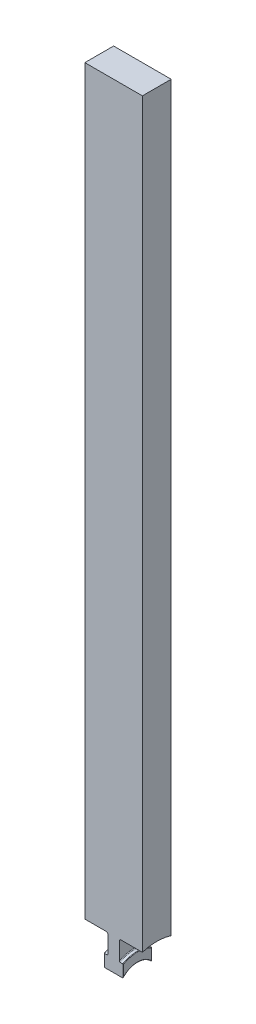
SolidWorks part; units mm, degrees
ref_plane "Front Plane" through (0, 0, 0) normal (0, 0, 1) x (1, 0, 0)
ref_plane "Top Plane" through (0, 0, 0) normal (0, 1, 0) x (1, 0, 0)
ref_plane "Right Plane" through (0, 0, 0) normal (1, 0, 0) x (0, 0, -1)
sketch "Sketch1" plane through (0, 0, 0) normal (1, 0, 0) x (0, 0, -1)
  line L0 (-7.5, 410) -> (-7.5, 0)
  line L1 (0, 249.2329) -> (0, 0) construction
  line L2 (7.5, 410) -> (7.5, 0)
  line L3 (-7.5, 410) -> (7.5, 410)
  line L6 (-7.5, 0) -> (7.5, 0)
  arc A0 (-10, 0) -> (10, 0) centre (0, 0) cw construction
  dimension "R" = 10
  dimension "L" = 400
  dimension "T" = 15
extrude "Boss-Extrude1" add sketch "Sketch1" along normal mid plane 30
sketch "Sketch8" plane through (0, 0, 0) normal (1, 0, 0) x (0, 0, -1)
  circle A0 centre (0, 0) radius 10
  arc A1 (10, 0) -> (-10, 0) centre (0, 0) ccw construction
extrude "Cut-Extrude4" cut sketch "Sketch8" against normal through all both and the other way through all
sketch "Sketch2" plane through (0, 0, 0) normal (0, 0, 1) x (1, 0, 0)
  line L0 (15, 15) -> (3, 15)
  line L1 (15, 410) -> (15, 6.6144) construction
  line L2 (3, 15) -> (3, 24.5)
  line L3 (3, 24.5) -> (15, 24.5)
  line L4 (15, 24.5) -> (15, 15)
  line L5 (0, 29.9173) -> (0, 0) construction
  line L6 (-15, 24.5) -> (-15, 15)
  line L7 (-3, 24.5) -> (-15, 24.5)
  line L8 (-3, 15) -> (-3, 24.5)
  line L9 (-15, 15) -> (-3, 15)
  line L10 (-8.8482, 0) -> (24.5305, 0) construction
  dimension "D1" = 6
  dimension "D2" = 24.5
  dimension "D3" = 15
revolve "Cut-Revolve1" cut sketch "Sketch2" angle 360 about L10
sketch "Sketch7" plane through (0, 0, 0) normal (0, 0, 1) x (1, 0, 0)
  line L6 (-15, 15) -> (-5, 15)
  line L8 (-15, 15) -> (-15, 0)
  line L9 (-15, 0) -> (-5, 0)
  line L10 (-5, 15) -> (-5, 0)
  line L11 (0, 16.5651) -> (0, 5.9342) construction
  line L12 (5, 15) -> (5, 0)
  line L13 (15, 0) -> (5, 0)
  line L14 (15, 15) -> (15, 0)
  line L15 (15, 15) -> (5, 15)
  dimension "MW" = 10
extrude "Cut-Extrude3" cut sketch "Sketch7" against normal through all both and the other way through all
fillet "Fillet1" radius 0.762 2 edges at (-3, 24.5, 0) (3, 24.5, 0)
fillet "Fillet2" radius 0.381 2 edges at (-3, 15, 0) (3, 15, 0)
fillet "Fillet3" radius 0.25 8 edges at (-5, 10, 0) (-5, 9.8024, -7.5) (-5, 15, 0) (-5, 9.8024, 7.5) (5, 10, 0) (5, 9.8024, 7.5) (5, 15, 0) (5, 9.8024, -7.5)
